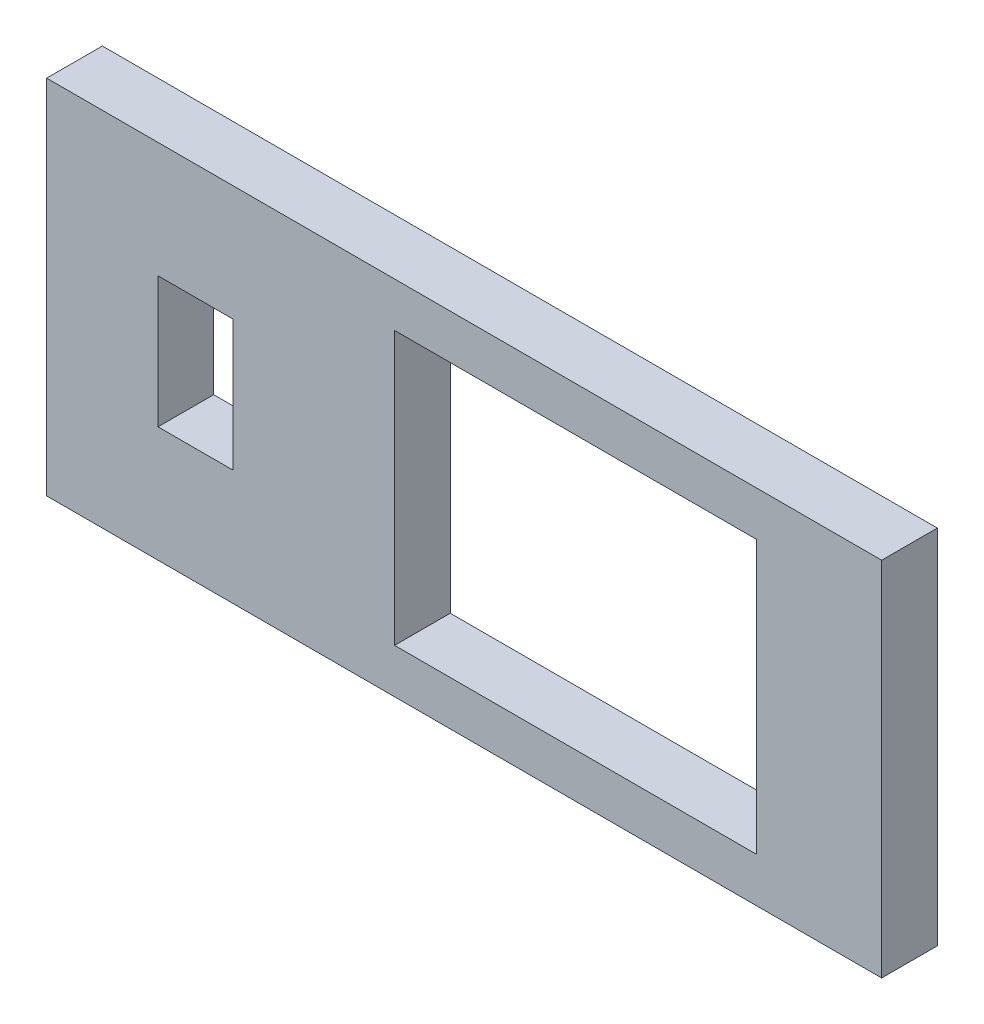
SolidWorks part; units mm, degrees
ref_plane "Ebene vorne" through (0, 0, 0) normal (0, 0, 1) x (1, 0, 0)
ref_plane "Ebene oben" through (0, 0, 0) normal (0, 1, 0) x (1, 0, 0)
ref_plane "Ebene rechts" through (0, 0, 0) normal (1, 0, 0) x (0, 0, -1)
sketch "Skizze1" plane through (0, 0, 0) normal (0, 1, 0) x (1, 0, 0)
  line L1 (0, 0) -> (-300, 0)
  line L2 (0, 0) -> (0, -20)
  line L3 (0, -20) -> (-300, -20)
  line L4 (-300, 0) -> (-300, -20)
  dimension "D1" = 300
  dimension "D2" = 20
extrude "Aufsatz-Linear austragen1" add sketch "Skizze1" along normal blind 130
sketch "Skizze2" plane through (0, 0, 20) normal (0, 0, 1) x (1, 0, 0)
  line L4 (-260, 88.5) -> (-233, 88.5)
  line L5 (-260, 88.5) -> (-260, 41.5)
  line L6 (-260, 41.5) -> (-233, 41.5)
  line L7 (-233, 88.5) -> (-233, 41.5)
  dimension "D3" = 47
  dimension "D4" = 27
extrude "Schnitt-Linear austragen1" cut sketch "Skizze2" against normal blind 20
sketch "Skizze3" plane through (0, 0, 20) normal (0, 0, 1) x (1, 0, 0)
  line L0 (0, 130) -> (0, 65)
  line L1 (0, 130) -> (0, 0) construction
  line L5 (-45, 114) -> (-175, 114)
  line L6 (-45, 114) -> (-45, 16)
  line L7 (-45, 16) -> (-175, 16)
  line L8 (-175, 114) -> (-175, 16)
  dimension "D3" = 130
  dimension "D4" = 98
extrude "Schnitt-Linear austragen2" cut sketch "Skizze3" against normal blind 20 contours L5 L8 L7 L6
